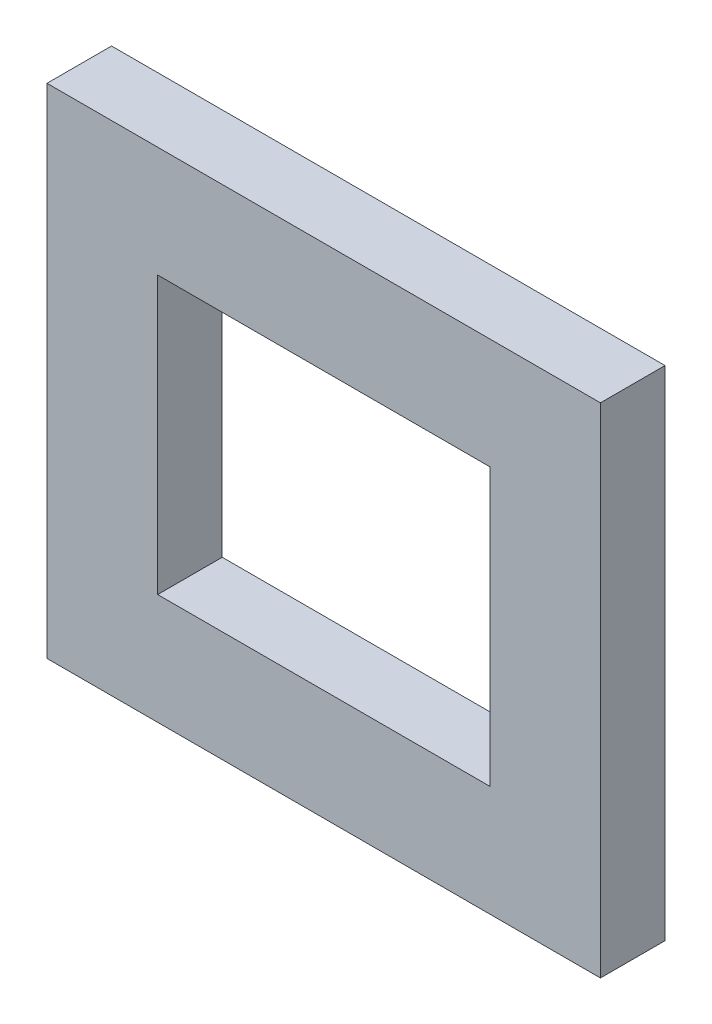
SolidWorks part; units mm, degrees
ref_plane "Front Plane" through (0, 0, 0) normal (0, 0, 1) x (1, 0, 0)
ref_plane "Top Plane" through (0, 0, 0) normal (0, 1, 0) x (1, 0, 0)
ref_plane "Right Plane" through (0, 0, 0) normal (1, 0, 0) x (0, 0, -1)
sketch "Sketch1" plane through (0, 0, 0) normal (0, 0, 1) x (1, 0, 0)
  line L0 (-95.25, 85.725) -> (95.25, 85.725)
  line L7 (95.25, 85.725) -> (95.25, -85.725)
  line L8 (-95.25, -85.725) -> (95.25, -85.725)
  line L9 (-95.25, 85.725) -> (-95.25, -85.725)
  line L10 (-57.15, 47.625) -> (-57.15, -47.625)
  line L11 (-57.15, -47.625) -> (57.15, -47.625)
  line L12 (57.15, 47.625) -> (57.15, -47.625)
  line L13 (-57.15, 47.625) -> (57.15, 47.625)
  point P0 (0, 0)
  dimension "D1" = 57.15
  dimension "D2" = 114.3
  dimension "D3" = 47.625
  dimension "D4" = 95.25
  dimension "D5" = 38.1
  dimension "D6" = 38.1
  dimension "D7" = 38.1
  dimension "D8" = 38.1
extrude "Boss-Extrude1" add sketch "Sketch1" along normal blind 22.225
